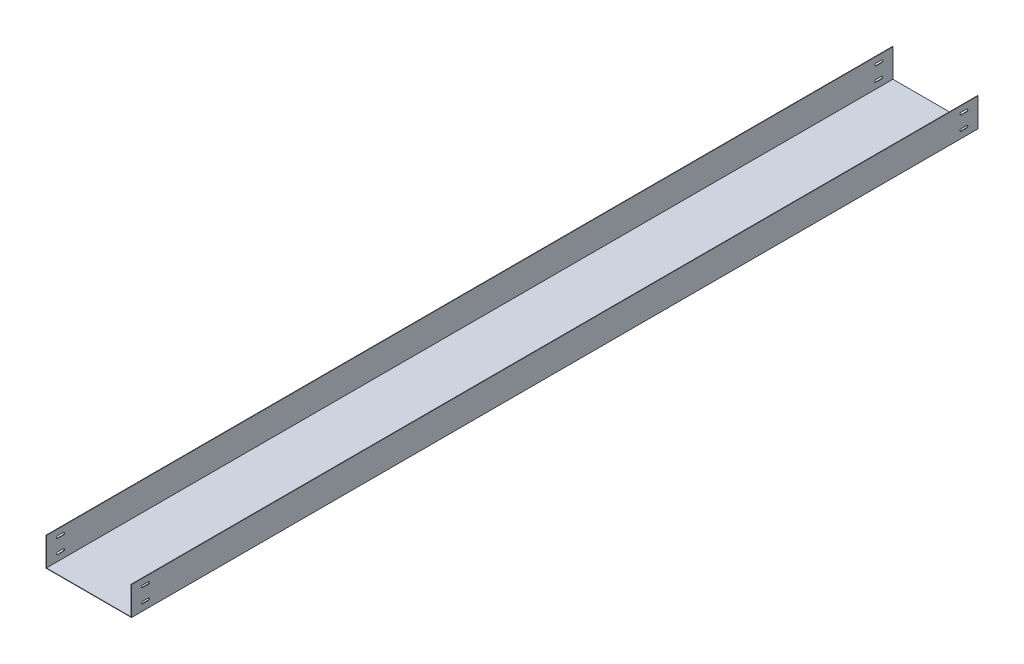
SolidWorks part; units mm, degrees
ref_plane "Front Plane" through (0, 0, 0) normal (0, 0, 1) x (1, 0, 0)
ref_plane "Top Plane" through (0, 0, 0) normal (0, 1, 0) x (1, 0, 0)
ref_plane "Right Plane" through (0, 0, 0) normal (1, 0, 0) x (0, 0, -1)
sketch "DuctSketch" plane through (0, 0, 0) normal (0, 0, 1) x (1, 0, 0)
  line L0 (-150, 0) -> (150, 0)
  line L1 (150, 0) -> (150, 100)
  line L2 (-150, 0) -> (-150, 100)
extrude "Extrusion" add sketch "DuctSketch" along normal blind 3000 thin
sketch "FilterSketch" plane through (0, 0, 0) normal (0, 0, 1) x (1, 0, 0)
  line L1 (150, 100) -> (-150, 100)
  line L2 (150, 100) -> (150, 0)
  line L3 (150, 0) -> (-150, 0)
  line L4 (-150, 100) -> (-150, 0)
  dimension "NominalHeight" = 100
  dimension "NominalWidth" = 300
sketch "Sketch1" plane through (0, 0, 0) normal (1, 0, 0) x (0, 0, -1)
  line L0 (0, 50) -> (-100, 50) construction
  line L2 (-50, 50) -> (-50, 0) construction
  line L4 (-50, 50) -> (-50, 100) construction
  line L6 (-60, 75) -> (-40, 75) construction
  line L7 (-60, 79) -> (-40, 79)
  line L8 (-60, 71) -> (-40, 71)
  line L9 (-60, 25) -> (-40, 25) construction
  line L10 (-60, 29) -> (-40, 29)
  line L11 (-60, 21) -> (-40, 21)
  line L14 (0, -1.5) -> (0, 100) construction
  arc A0 (-60, 79) -> (-60, 71) centre (-60, 75) ccw
  arc A1 (-40, 71) -> (-40, 79) centre (-40, 75) ccw
  arc A2 (-60, 29) -> (-60, 21) centre (-60, 25) ccw
  arc A3 (-40, 21) -> (-40, 29) centre (-40, 25) ccw
  point P13 (-50, 75)
  point P19 (-50, 25)
extrude "Cut-Extrude1" cut sketch "Sketch1" against normal through all and the other way through all
sketch "Sketch2" plane through (0, 0, 0) normal (1, 0, 0) x (0, 0, -1)
  line L0 (-3000, 50) -> (-2900, 50) construction
  line L1 (-2950, 50) -> (-2950, 100) construction
  line L2 (-2950, 50) -> (-2950, 0) construction
  line L3 (-3000, -1.5) -> (-3000, 100) construction
  line L4 (-2960, 75) -> (-2940, 75) construction
  line L5 (-2960, 79) -> (-2940, 79)
  line L6 (-2960, 71) -> (-2940, 71)
  line L7 (-2960, 25) -> (-2940, 25) construction
  line L8 (-2960, 29) -> (-2940, 29)
  line L9 (-2960, 21) -> (-2940, 21)
  arc A0 (-2960, 79) -> (-2960, 71) centre (-2960, 75) ccw
  arc A1 (-2940, 71) -> (-2940, 79) centre (-2940, 75) ccw
  arc A2 (-2960, 29) -> (-2960, 21) centre (-2960, 25) ccw
  arc A3 (-2940, 21) -> (-2940, 29) centre (-2940, 25) ccw
  point P10 (-2950, 75)
  point P16 (-2950, 25)
extrude "Cut-Extrude2" cut sketch "Sketch2" against normal through all and the other way through all
equation "\"D3@Sketch1\"= \"Height@DuctSketch\" / 2"
equation "\"D4@Sketch1\"=\"Height@DuctSketch\"/2"
equation "\"D2@Sketch2\"=\"Height@DuctSketch\"/2"
equation "\"D3@Sketch2\"=\"Height@DuctSketch\"/2"
equation "\"Cut-Extrude1\" = if ( \"Length@Extrusion\" < = 50mm , \"suppressed\" , \"unsuppressed\" )"
equation "\"Cut-Extrude2\"= if ( \"Length@Extrusion\" < = 100mm , \"suppressed\" , \"unsuppressed\" )"
